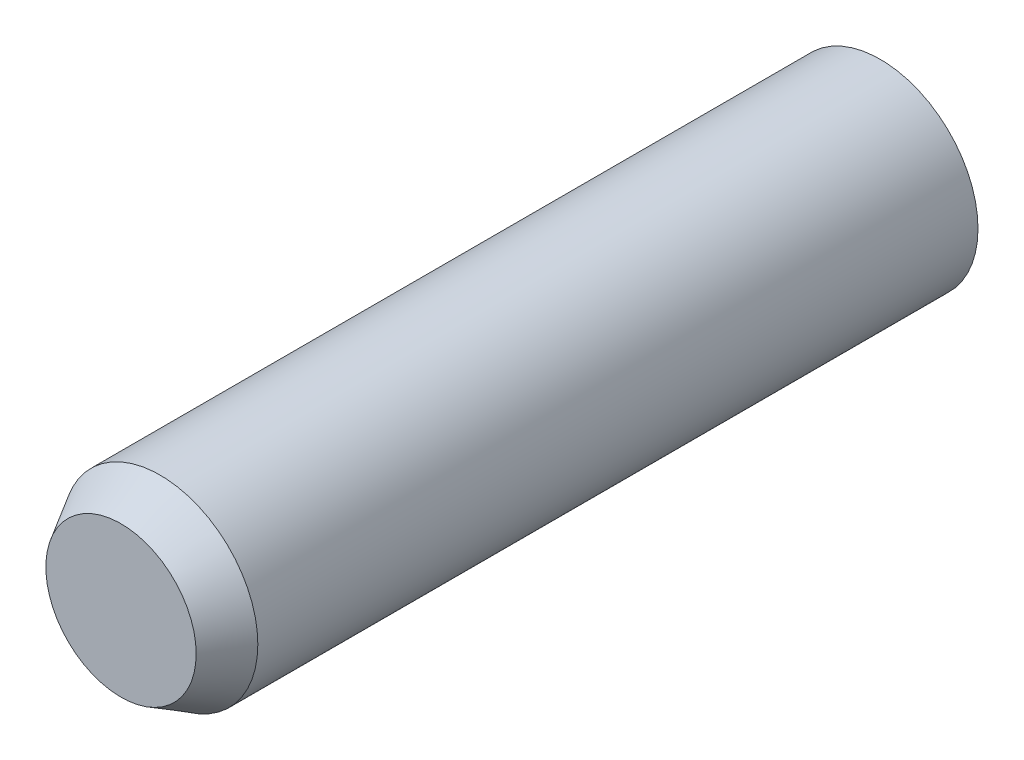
SolidWorks part; units mm, degrees
ref_plane "Front" through (0, 0, 0) normal (0, 0, 1) x (1, 0, 0)
ref_plane "Top" through (0, 0, 0) normal (0, 1, 0) x (1, 0, 0)
ref_plane "Right" through (0, 0, 0) normal (1, 0, 0) x (0, 0, -1)
sketch "Sketch1" plane through (0, 0, 0) normal (0, 0, 1) x (1, 0, 0)
  circle A0 centre (0, 0) radius 6.35
  dimension "D1" = 12.7
extrude "Boss-Extrude1" add sketch "Sketch1" along normal blind 50.8 contours A0
chamfer "Chamfer1" distance 2.54 angle 30 2 edges at (6.35, 0, 0) (6.35, 0, 50.8)
